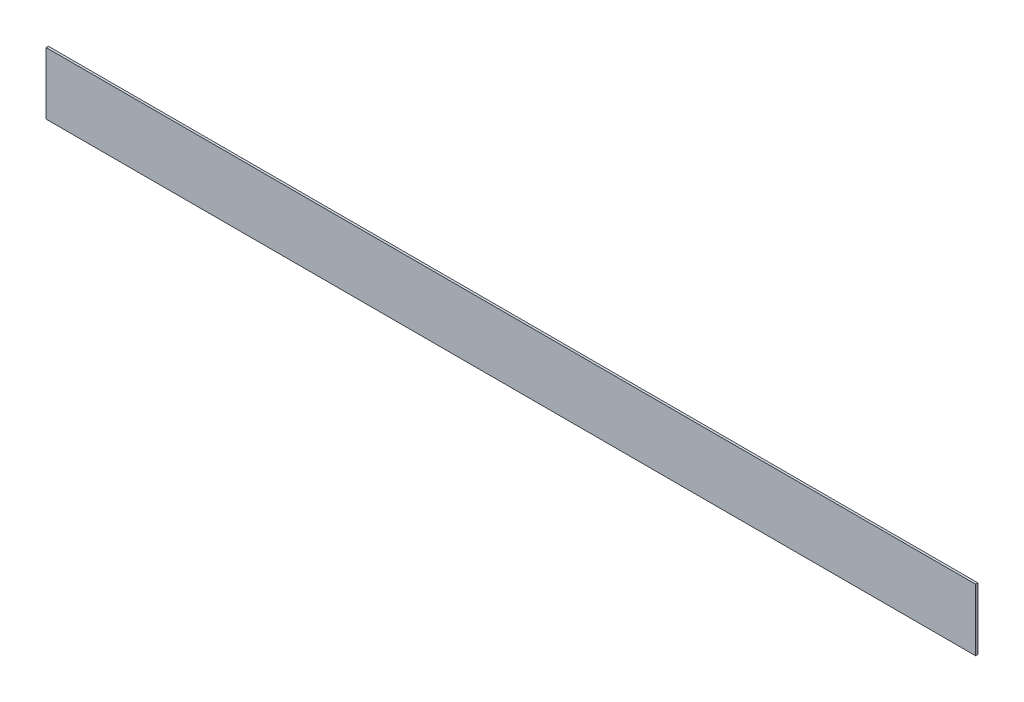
SolidWorks part; units mm, degrees
ref_plane "Front Plane" through (0, 0, 0) normal (0, 0, 1) x (1, 0, 0)
ref_plane "Top Plane" through (0, 0, 0) normal (0, 1, 0) x (1, 0, 0)
ref_plane "Right Plane" through (0, 0, 0) normal (1, 0, 0) x (0, 0, -1)
sketch "Sketch2" plane through (0, 0, 0) normal (0, 1, 0) x (1, 0, 0)
  line L1 (0, 0) -> (3048, 0)
  line L2 (0, 0) -> (0, 7.62)
  line L3 (0, 7.62) -> (3048, 7.62)
  line L4 (3048, 0) -> (3048, 7.62)
  dimension "D1" = 3048
  dimension "D2" = 7.62
extrude "Boss-Extrude1" add sketch "Sketch2" against normal blind 203.2
